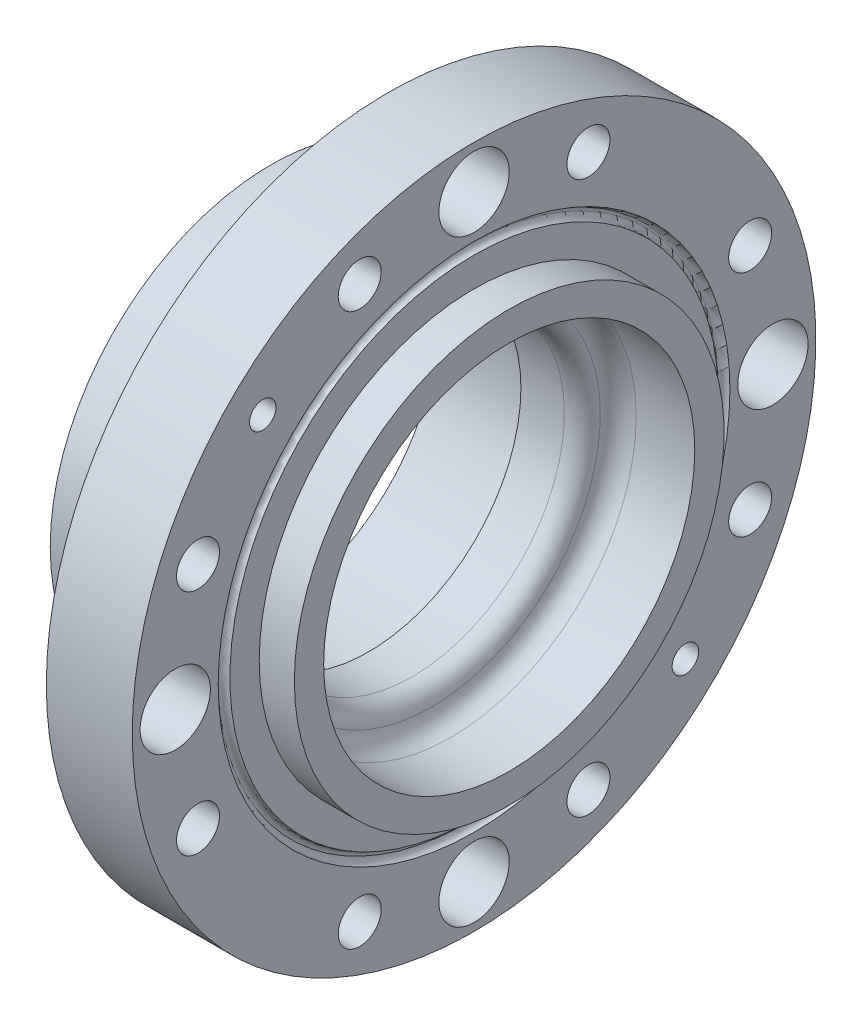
SolidWorks part; units mm, degrees
ref_plane "Plan de face" through (0, 0, 0) normal (0, 0, 1) x (1, 0, 0)
ref_plane "Plan de dessus" through (0, 0, 0) normal (0, 1, 0) x (1, 0, 0)
ref_plane "Plan de droite" through (0, 0, 0) normal (1, 0, 0) x (0, 0, -1)
sketch "Esquisse1" plane through (0, 0, 0) normal (0, 0, 1) x (1, 0, 0)
  line L0 (0, 56.5001) -> (0, 0)
  line L1 (22.0002, 56.5001) -> (0, 56.5001)
  line L2 (0, 0) -> (60.9998, 0)
  line L28 (51.9998, 87.4997) -> (51.9998, 55)
  line L52 (51.9998, 87.4997) -> (30.0004, 87.4997)
  line L57 (30.0004, 87.4997) -> (30.0004, 64.5001)
  line L58 (22.0002, 56.5001) -> (0, 56.5001)
  line L72 (60.9998, 0) -> (60.9998, 55)
  line L73 (60.9998, 55) -> (51.9998, 55)
  line L110 (0, 0) -> (84.9003, 0) construction
  arc A22 (22.0002, 56.5001) -> (30.0004, 64.5001) centre (22.0004, 64.5001) ccw
  arc A40 (30.0004, 64.5001) -> (22.0002, 56.5001) centre (22.0004, 64.5001) cw
  dimension "D16" = 8
  dimension "D2" = 8.0002
  dimension "D3" = 55
  dimension "D4" = 9
  dimension "D7" = 87.4997
  dimension "D8" = 21.9994
  dimension "D12" = 22.0002
revolve "Révolution1" add sketch "Esquisse1" angle 360 about L110
sketch "Esquisse2" plane through (30.0004, 0, 0) normal (-1, 0, 0) x (0, 0, 1)
  line L0 (0, 94.5485) -> (0, 0) construction
  line L1 (0, 0) -> (-40.2222, 97.1049) construction
  line L2 (0.001, 0) -> (-29.2753, 70.6768) construction
  line L3 (0.001, 0) -> (29.2756, 70.6775) construction
  circle A0 centre (0, 0) radius 76.5 construction
  circle A1 centre (-29.2753, 70.6768) radius 5.5
  circle A2 centre (29.2756, 70.6775) radius 5.5
  dimension "D2" = 153
  dimension "D3" = 11
  dimension "D1" = 22.5
  dimension "D4" = 45
extrude "Extrusion1" cut sketch "Esquisse2" against normal blind 28
pattern_circular "Répétition circulaire1" count 4 over 360 about axis through (0, 0, 0) along (1, 0, 0) of "Extrusion1"
sketch "Esquisse3" plane through (30.0004, 0, 0) normal (-1, 0, 0) x (0, 0, 1)
  line L0 (0, 95.003) -> (0, 0) construction
  circle A0 centre (0, 76.5) radius 9
  circle A1 centre (0, 0) radius 76.5 construction
  circle A2 centre (76.5, 0) radius 9
  circle A3 centre (0, -76.5) radius 9
  circle A4 centre (-76.5, 0) radius 9
  dimension "D1" = 18
extrude "Extrusion2" cut sketch "Esquisse3" against normal blind 28
sketch "Esquisse4" plane through (30.0004, 0, 0) normal (-1, 0, 0) x (0, 0, 1)
  line L0 (0, 109.9126) -> (0, 0) construction
  line L1 (0, 0) -> (87.796, 87.796) construction
  circle A0 centre (0, 0) radius 76.5 construction
  circle A1 centre (54.0937, 54.0937) radius 7.5
  point P3 (54.0937, 54.0937)
  dimension "D2" = 15
  dimension "D1" = 45
extrude "Extrusion3" cut sketch "Esquisse4" against normal blind 10
hole_wizard "Trou taraudé M81" positions "Esquisse3D3" profile "Esquisse8" tap size "M8" standard "ISO"
sketch3d "Esquisse3D3"
  line L0 (40.0004, 54.0937, 54.0937) -> (30.0004, 54.0937, 54.0937) construction
  point P0 (40.0004, 54.0937, 54.0937)
sketch "Esquisse8" plane through (40.0004, 54.0937, 54.0937) normal (0, 1, 0) x (0, 0, 1)
  line L0 (0, 0) -> (0, 20.9994)
  line L1 (0, 20.9994) -> (3.4, 20.9994)
  line L2 (3.4, 20.9994) -> (3.4, 0)
  line L5 (3.4, 0) -> (0, 0)
  line L11 (0, -6.35) -> (0, 107.95) construction
  dimension "Diamètre du trou pour taraudage jusqu'au prochain" = 6.8
  dimension "Profondeur du trou pour taraudage jusqu'au prochain" = 20.9994
pattern_circular "Répétition circulaire2" count 2 over 360 about axis through (0, 0, 0) along (1, 0, 0) of "Extrusion3", "Trou taraudé M81"
hole_wizard "Trou taraudé M62" positions "Esquisse12" profile "Esquisse11" tap size "M6" standard "ISO"
sketch "Esquisse12" plane through (0, 0, 0) normal (-1, 0, 0) x (0, 0, 1)
  point P0 (0, 48.5)
  dimension "D1" = 48.5
sketch "Esquisse11" plane through (0, 48.5, 0) normal (0, 1, 0) x (0, 0, 1)
  line L0 (0, 0) -> (0, 19.5022)
  line L1 (0, 19.5022) -> (2.5, 18)
  line L2 (2.5, 18) -> (2.5, 0)
  line L5 (2.5, 0) -> (0, 0)
  line L10 (0, 19.5022) -> (-2.5, 18) construction
  line L11 (0, -6.35) -> (0, 107.95) construction
  dimension "Diamètre du trou pour taraudage" = 5
  dimension "Profondeur du trou pour taraudage" = 18
  dimension "Angle de pointe" = 118
pattern_circular "Répétition circulaire4" count 8 every 45 about axis through (0, 0, 0) along (1, 0, 0) of "Trou taraudé M62"
sketch "Esquisse13" plane through (0, 0, 0) normal (-1, 0, 0) x (0, 0, 1)
  circle A0 centre (0, 0) radius 27.5
  dimension "D1" = 55
extrude "Extrusion4" cut sketch "Esquisse13" against normal through all
sketch "Esquisse14" plane through (0, 0, 0) normal (-1, 0, 0) x (0, 0, 1)
  circle A0 centre (0, 0) radius 39
  dimension "D1" = 78
extrude "Extrusion5" cut sketch "Esquisse14" against normal blind 5
sketch "Esquisse15" plane through (60.9998, 0, 0) normal (1, 0, 0) x (0, 0, -1)
  circle A0 centre (0, 0) radius 47.5
  dimension "D1" = 95
extrude "Extrusion6" cut sketch "Esquisse15" against normal blind 20
sketch "Esquisse16" plane through (40.9998, 0, 0) normal (1, 0, 0) x (0, 0, -1)
  circle A0 centre (0, 0) radius 39
  dimension "D1" = 78
extrude "Extrusion7" cut sketch "Esquisse16" against normal blind 50
sketch "Esquisse18" plane through (51.9998, 0, 0) normal (1, 0, 0) x (0, 0, -1)
  circle A0 centre (0, 0) radius 65.5
  circle A1 centre (0, 0) radius 62.5
  dimension "D1" = 131
  dimension "D2" = 125
extrude "Extrusion9" cut sketch "Esquisse18" against normal blind 1.5
fillet "Congé1" radius 1.5 2 edges at (50.4998, 62.5, 0) (50.4998, 65.5, 0)
sketch "Esquisse19" plane through (0, 0, 0) normal (-1, 0, 0) x (0, 0, 1)
  circle A0 centre (0, 0) radius 42.5
  dimension "D1" = 85
extrude "Extrusion10" cut sketch "Esquisse19" against normal blind 25
fillet "Congé2" radius 5 1 edges at (40.9998, 47.5, 0)
fillet "Congé3" radius 5 1 edges at (40.9998, 39, 0)
